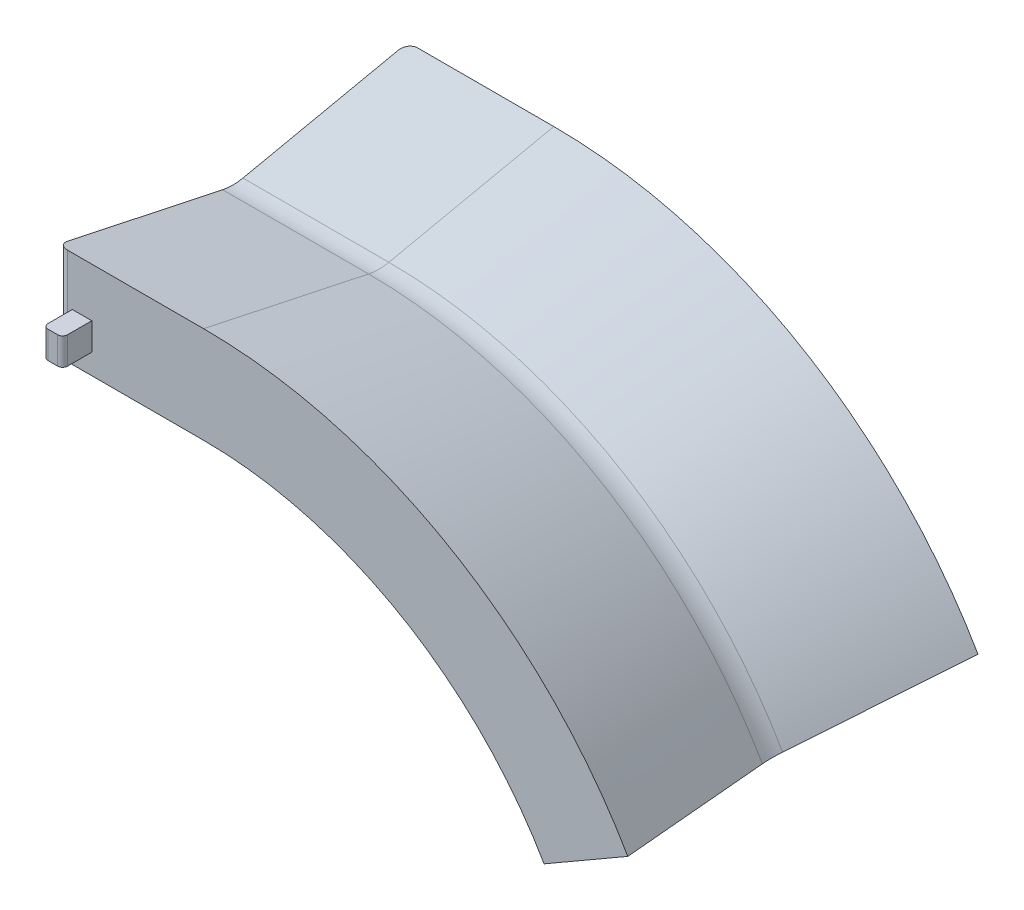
SolidWorks part; units mm, degrees
ref_plane "前视基准面" through (0, 0, 0) normal (0, 0, 1) x (1, 0, 0)
ref_plane "上视基准面" through (0, 0, 0) normal (0, 1, 0) x (1, 0, 0)
ref_plane "右视基准面" through (0, 0, 0) normal (1, 0, 0) x (0, 0, -1)
sketch "草图1" plane through (0, 0, 0) normal (1, 0, 0) x (0, 0, -1)
  line L0 (0, 62.7931) -> (0, -49.1234) construction
  line L1 (-18, 0) -> (18, 0)
  line L2 (18, 9.9393) -> (18, 0)
  line L3 (18, 9.9393) -> (1.0404, 6.3313)
  line L4 (-18, 9.9393) -> (-1.0404, 6.3313)
  line L5 (-18, 9.9393) -> (-18, 0)
  arc A0 (1.0404, 6.3313) -> (-1.0404, 6.3313) centre (0, 11.2219) cw
  point P7 (0, 0)
  point P9 (0, 0)
  point P10 (0, 6.11)
  point P11 (0, 6.11)
  dimension "D4" = 5
  dimension "D1" = 6.11
  dimension "D2" = 77.99
  dimension "D3" = 18
sketch "草图2" plane through (0, 0, 0) normal (0, 0, 1) x (1, 0, 0)
  line L0 (0, 0) -> (15, 0)
  line L1 (50, -20.2073) -> (15, -40.4145) construction
  line L2 (15, -18.8522) -> (15, -46.3904) construction
  line L3 (0, 62.7931) -> (0, -49.1234) construction
  arc A0 (15, 0) -> (50, -20.2073) centre (15, -40.4145) cw
  dimension "D1" = 15
  dimension "D2" = 60
  dimension "D3" = 50
sweep "扫描1" add profiles "草图1" path "草图2"
fillet "圆角1" radius 1 2 edges at (0, 4.9696, -18) (0, 4.9696, 18)
ref_plane "基准面1" through (0, 4.9, 0) normal (0, 1, 0) x (1, 0, 0)
sketch "草图4" plane through (0, 4.9, 0) normal (0, 1, 0) x (1, 0, 0)
  line L0 (1.5, -18) -> (1.5, -20.5)
  line L1 (15, -18) -> (1, -18) construction
  line L2 (2, -21) -> (3, -21)
  line L3 (3.5, -20.5) -> (3.5, -18)
  line L4 (0, -1.0404) -> (0, -17) construction
  line L5 (1.5, -18) -> (3.5, -18)
  arc A0 (3, -21) -> (3.5, -20.5) centre (3, -20.5) ccw
  arc A1 (1.5, -20.5) -> (2, -21) centre (2, -20.5) ccw
  point P10 (3.5, -21)
  point P13 (1.5, -21)
  dimension "D4" = 0.5
  dimension "D1" = 3
  dimension "D2" = 2
  dimension "D3" = 1.5
extrude "凸台-拉伸2" add sketch "草图4" against normal blind 2.8
mirror "镜向1" about plane through (0, 0, 0) normal (0, 0, 1) of "凸台-拉伸2"
